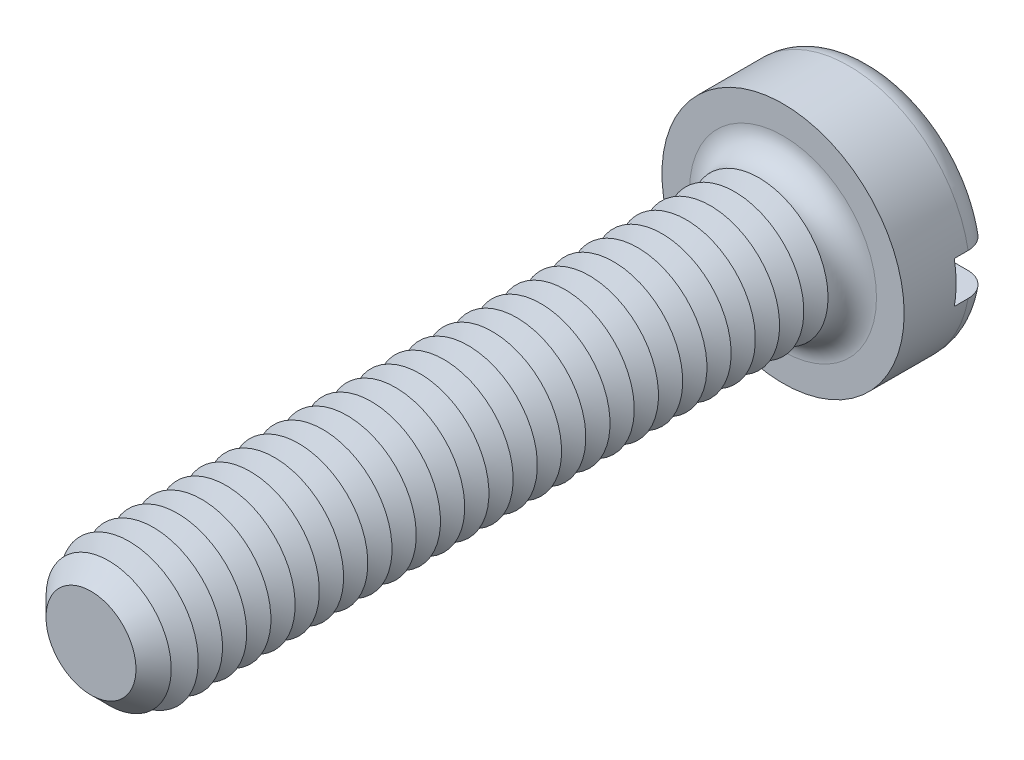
SolidWorks part; units mm, degrees
ref_plane "Front Plane" through (0, 0, 0) normal (0, 0, 1) x (1, 0, 0)
ref_plane "Top Plane" through (0, 0, 0) normal (0, 1, 0) x (1, 0, 0)
ref_plane "Right Plane" through (0, 0, 0) normal (1, 0, 0) x (0, 0, -1)
sketch "Sketch3" plane through (0, 0, 0) normal (0, 0, 1) x (1, 0, 0)
  circle A0 centre (0, 0) radius 3.5
  dimension "D1" = 7
extrude "Boss-Extrude2" add sketch "Sketch3" against normal blind 2.6
sketch "Sketch4" plane through (0, 0, 0) normal (0, 0, 1) x (1, 0, 0)
  circle A0 centre (0, 0) radius 2
  dimension "D1" = 4
extrude "Boss-Extrude3" add sketch "Sketch4" along normal blind 20
fillet "Fillet1" radius 0.7 2 edges at (3.5, 0, -2.6) (2, 0, 0)
chamfer "Chamfer1" distance 0.7 angle 45 1 edges at (2, 0, 20)
sketch "Sketch5" plane through (0, 0, 0) normal (1, 0, 0) x (0, 0, -1)
  line L0 (1.6944, 0) -> (-7.6738, 0) construction
sketch "Sketch6" plane through (0, 0, 0) normal (1, 0, 0) x (0, 0, -1)
  line L0 (-0.7, 2) -> (-1.05, 1.3938)
  line L1 (-1.05, 1.3938) -> (-1.4, 2)
  line L2 (-0.7, 2) -> (-19.3, 2) construction
  line L3 (-1.4, 2) -> (-0.7, 2)
  dimension "D1" = 0.7
revolve "Cut-Revolve1" cut sketch "Sketch6" angle 360 about L0
pattern_linear "LPattern1" count 27 spacing 0.7 along (0, 0, 1) of "Cut-Revolve1"
sketch "Sketch8" plane through (0, 0, -2.6) normal (0, 0, -1) x (-1, 0, 0)
  line L1 (3.5, -0.6) -> (-3.5, -0.6)
  line L2 (3.5, -0.6) -> (3.5, 0.6)
  line L3 (3.5, 0.6) -> (-3.5, 0.6)
  line L4 (-3.5, -0.6) -> (-3.5, 0.6)
  line L5 (3.5, -0.6) -> (-3.5, 0.6) construction
  line L6 (3.5, 0.6) -> (-3.5, -0.6) construction
  point P0 (0, 0)
  dimension "D1" = 7
  dimension "D2" = 1.2
extrude "Cut-Extrude1" cut sketch "Sketch8" against normal blind 1.1
